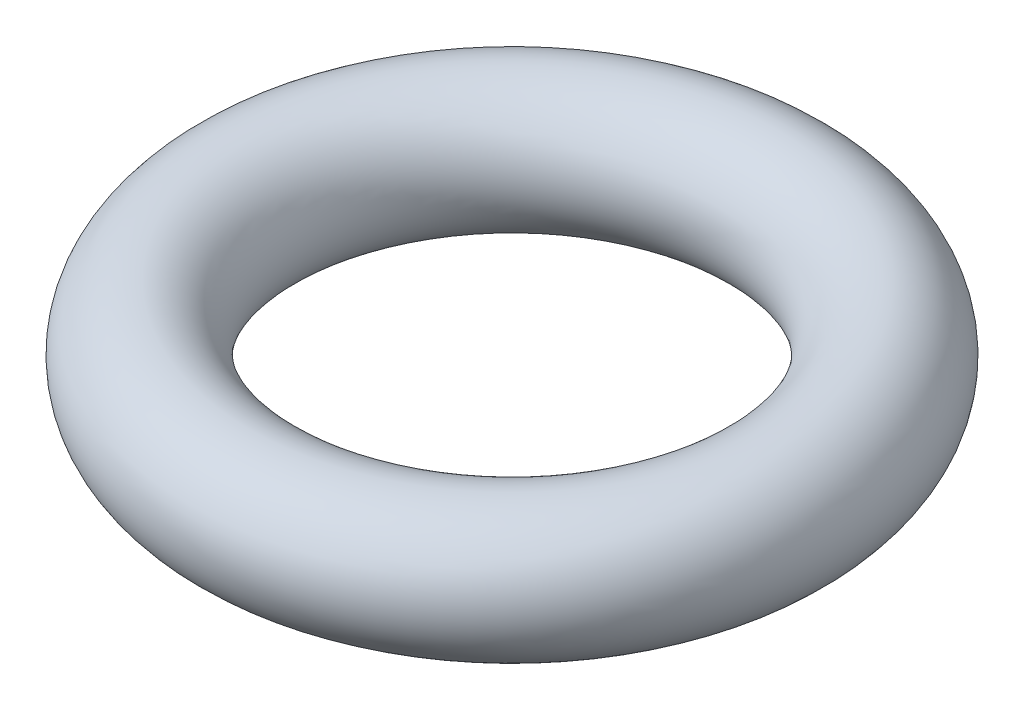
SolidWorks part; units mm, degrees
ref_plane "Plan de face" through (0, 0, 0) normal (0, 0, 1) x (1, 0, 0)
ref_plane "Plan de dessus" through (0, 0, 0) normal (0, 1, 0) x (1, 0, 0)
ref_plane "Plan de droite" through (0, 0, 0) normal (1, 0, 0) x (0, 0, -1)
sketch "Esquisse1" plane through (0, 0, 0) normal (0, 0, 1) x (1, 0, 0)
  line L0 (0, 0) -> (0, 18.3546) construction
  line L1 (0, 0) -> (3.4, 0) construction
  circle A0 centre (3.4, 0) radius 0.85
  point P5 (4.25, 0)
  dimension "D1" = 1.7
  dimension "D2" = 8.5
revolve "Révolution1" add sketch "Esquisse1" angle 360 about L0
